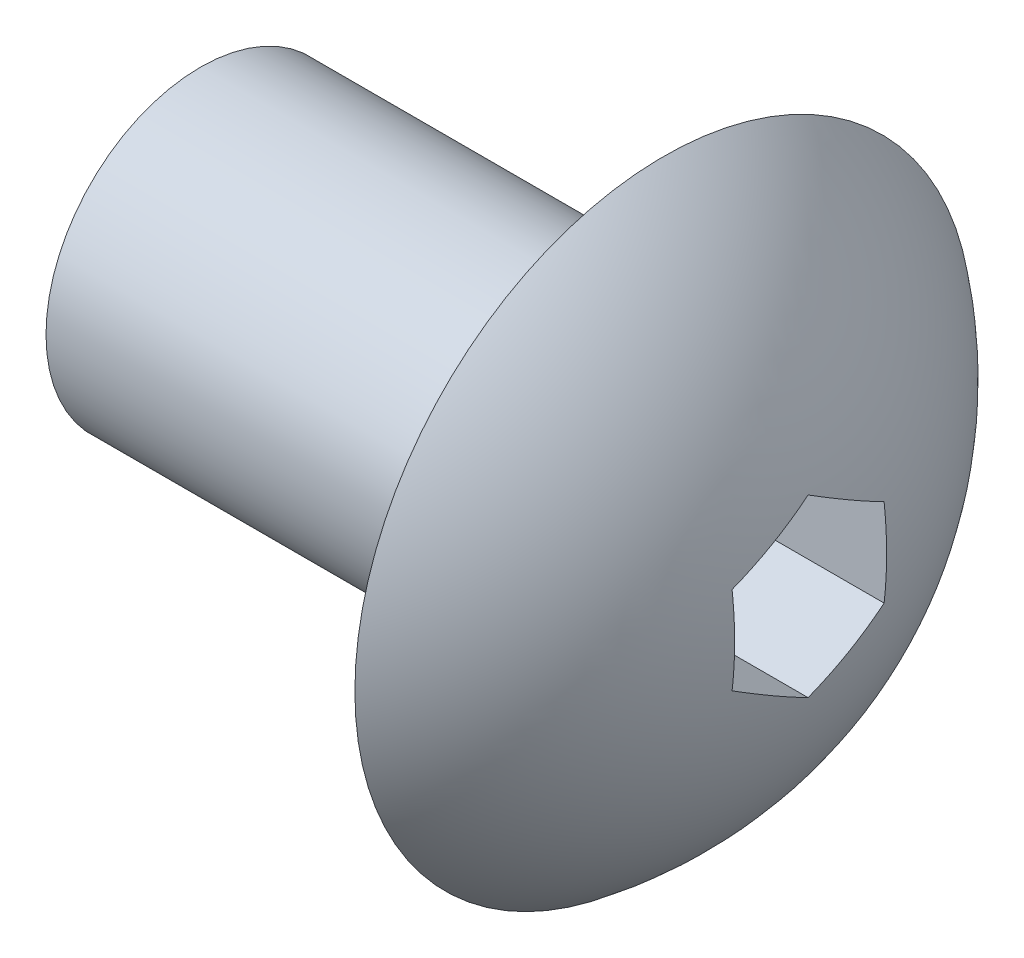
SolidWorks part; units mm, degrees
ref_plane "Front Plane" through (0, 0, 0) normal (0, 0, 1) x (1, 0, 0)
ref_plane "Top Plane" through (0, 0, 0) normal (0, 1, 0) x (1, 0, 0)
ref_plane "Right Plane" through (0, 0, 0) normal (1, 0, 0) x (0, 0, -1)
sketch "Sketch1" plane through (0, 0, 0) normal (0, 1, 0) x (1, 0, 0)
  line L0 (0, 0) -> (35.0838, 0) construction
  line L1 (0, 0) -> (0, -2.54)
  line L2 (0, -2.54) -> (7.62, -2.54)
  line L3 (7.62, -2.54) -> (7.62, -5.08)
  line L4 (0, 0) -> (10.16, 0)
  arc A0 (7.62, -5.08) -> (10.16, 0) centre (3.81, 0) ccw
  dimension "D1" = 12.7
  dimension "D2" = 2.54
  dimension "D3" = 2.54
  dimension "D4" = 7.62
revolve "Revolve1" add sketch "Sketch1" angle 360 about L0
ref_plane "Plane1" through (10.16, 0, 0) normal (1, 0, 0) x (0, 0, -1)
sketch "Sketch2" plane through (10.16, 0, 0) normal (1, 0, 0) x (0, 0, -1)
  line L1 (0, -1.4434) -> (1.25, -0.7217)
  line L2 (1.25, -0.7217) -> (1.25, 0.7217)
  line L3 (1.25, 0.7217) -> (0, 1.4434)
  line L4 (0, 1.4434) -> (-1.25, 0.7217)
  line L5 (-1.25, 0.7217) -> (-1.25, -0.7217)
  line L6 (-1.25, -0.7217) -> (0, -1.4434)
  circle A0 centre (0, 0) radius 1.25 construction
  dimension "D1" = 2.5
extrude "Cut-Extrude1" cut sketch "Sketch2" against normal blind 3.81
